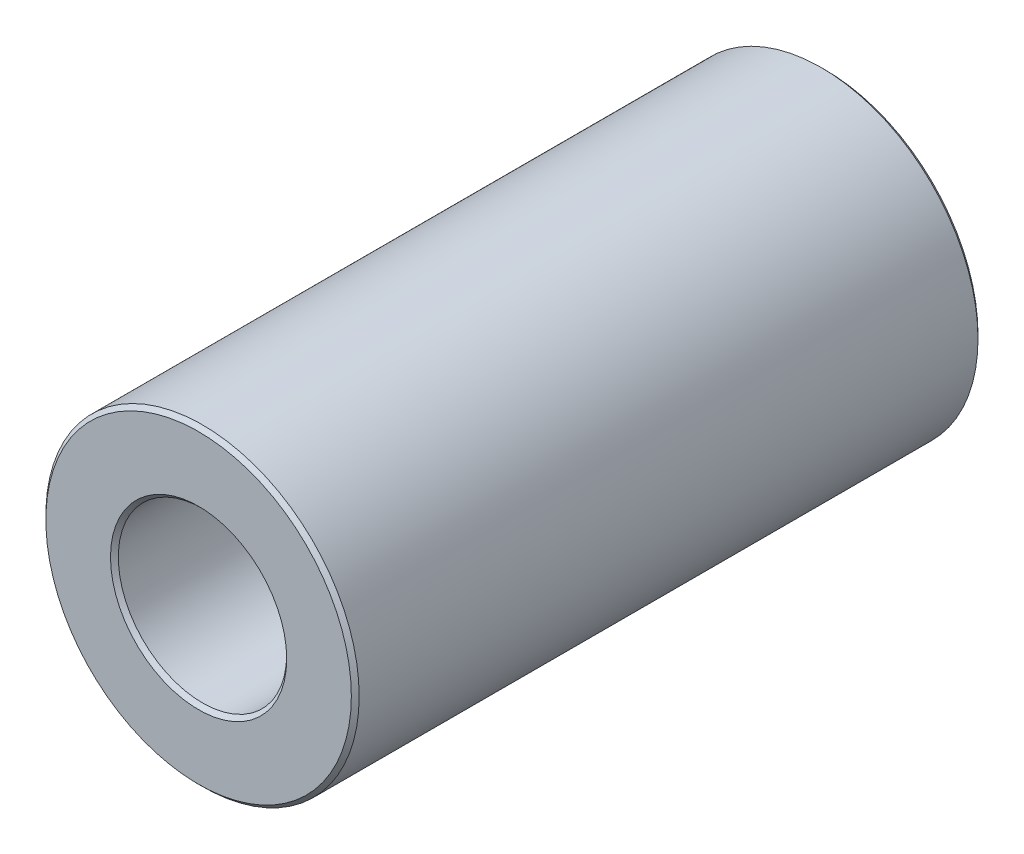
SolidWorks part; units mm, degrees
ref_plane "Front Plane" through (0, 0, 0) normal (0, 0, 1) x (1, 0, 0)
ref_plane "Top Plane" through (0, 0, 0) normal (0, 1, 0) x (1, 0, 0)
ref_plane "Right Plane" through (0, 0, 0) normal (1, 0, 0) x (0, 0, -1)
sketch "Sketch1" plane through (0, 0, 0) normal (0, 0, 1) x (1, 0, 0)
  circle A0 centre (0, 0) radius 4
  circle A1 centre (0, 0) radius 2.15
  dimension "D1" = 8
  dimension "D2" = 4.3
extrude "Boss-Extrude2" add sketch "Sketch1" along normal mid plane 16
chamfer "Chamfer3" distance 0.1 angle 45 4 edges at (4, 0, 8) (4, 0, -8) (2.15, 0, -8) (2.15, 0, 8)
